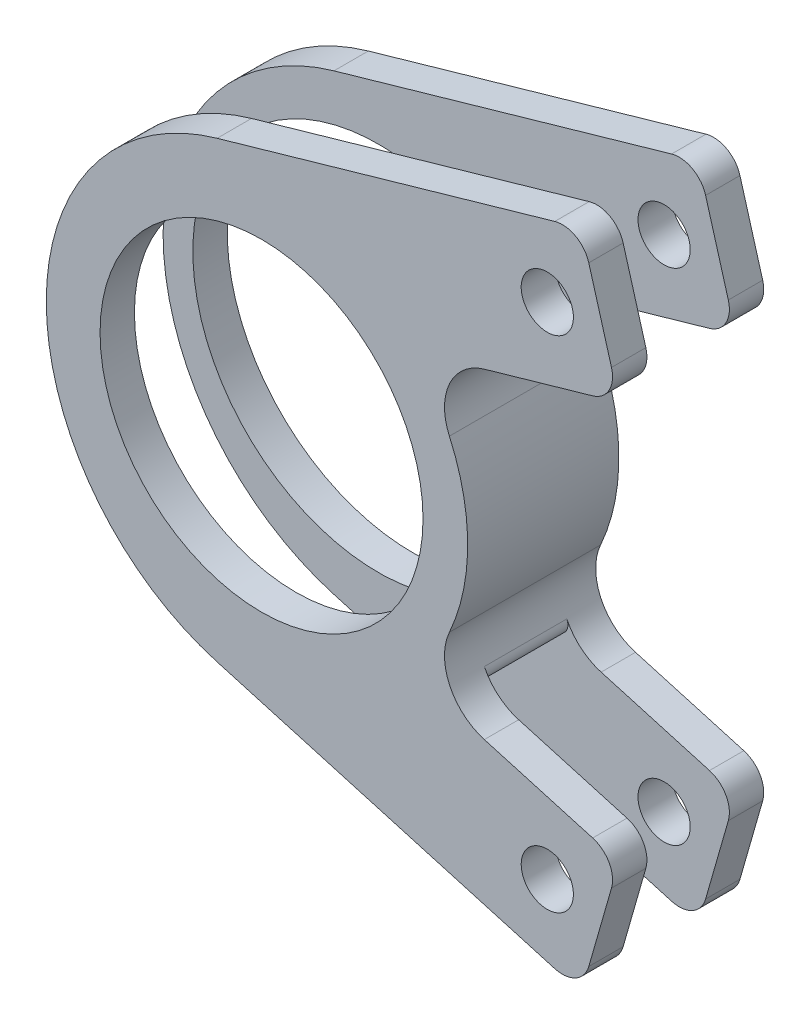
SolidWorks part; units mm, degrees
ref_plane "Plan de face" through (0, 0, 0) normal (0, 0, 1) x (1, 0, 0)
ref_plane "Plan de dessus" through (0, 0, 0) normal (0, 1, 0) x (1, 0, 0)
ref_plane "Plan de droite" through (0, 0, 0) normal (1, 0, 0) x (0, 0, -1)
sketch "Esquisse2" plane through (0, 0, 0) normal (0, 0, 1) x (1, 0, 0)
  line L0 (464.4706, 112.9482) -> (840.0604, 220.6469) construction
  line L1 (496.8579, 0) -> (841.4166, 0) construction
  line L2 (658.969, -116.7048) -> (737.7931, -139.3073)
  line L3 (496.8579, 0) -> (498.7091, 197.6026) construction
  line L4 (751.5056, 164.0452) -> (734.9673, 221.7209)
  line L5 (464.5491, 164.9857) -> (710.2293, 235.4334)
  line L6 (475.1704, -0.7722) -> (729.4546, 240.9462) construction
  line L7 (757.0183, 144.82) -> (498.7091, 197.6026) construction
  line L11 (498.7091, 197.6026) -> (475.627, 168.1623) construction
  line L12 (658.969, 116.7048) -> (737.7931, 139.3073)
  line L13 (751.5056, -164.0452) -> (734.9673, -221.7209)
  line L14 (464.5491, -164.9857) -> (710.2293, -235.4334)
  circle A0 centre (496.8579, 0) radius 117.5
  arc A1 (464.5491, 164.9857) -> (464.5491, -164.9857) centre (511.8579, 0) ccw
  circle A2 centre (704.786, 181.8576) radius 19
  arc A3 (658.969, -116.7048) -> (633.5447, -61.7797) centre (669.9945, -78.2543) cw
  arc A4 (633.5447, -61.7797) -> (633.5447, 61.7797) centre (496.8579, 0) ccw
  arc A5 (658.969, 116.7048) -> (633.5447, 61.7797) centre (669.9945, 78.2543) ccw
  arc A6 (734.9673, -221.7209) -> (710.2293, -235.4334) centre (715.7421, -216.2082) cw
  arc A7 (737.7931, -139.3073) -> (751.5056, -164.0452) centre (732.2803, -158.5325) cw
  arc A8 (734.9673, 221.7209) -> (710.2293, 235.4334) centre (715.7421, 216.2082) ccw
  arc A9 (737.7931, 139.3073) -> (751.5056, 164.0452) centre (732.2803, 158.5325) ccw
  circle A10 centre (704.786, -181.8576) radius 19
  point P9 (651.0997, 166.4633)
  point P31 (743.2364, 192.8831)
  point P34 (729.4546, -240.9462)
  point P37 (757.0183, -144.82)
  dimension "D1" = 235
  dimension "D2" = 40
  dimension "D6" = 38
  dimension "D9" = 150
  dimension "D10" = 20
  dimension "D3" = 15
  dimension "D4" = 16
  dimension "D5" = 100
  dimension "D7" = 250
  dimension "D8" = 40
extrude "Boss.-Extru.1" add sketch "Esquisse2" along normal mid plane 110 separate body
sketch "Esquisse4" plane through (0, 0, 0) normal (0, 0, 1) x (1, 0, 0)
  line L0 (849.7127, 171.3997) -> (620.0793, 105.5534)
  line L1 (658.969, 116.7048) -> (737.7931, 139.3073) construction
  line L2 (860.2294, -174.4153) -> (620.0793, -105.5534)
  line L3 (737.7931, -139.3073) -> (658.969, -116.7048) construction
  line L5 (849.7127, 171.3997) -> (849.7127, 282.3166)
  line L6 (849.7127, 282.3166) -> (305.9608, 282.3166)
  line L7 (305.9608, 282.3166) -> (305.9608, -264.0001)
  line L8 (305.9608, -264.0001) -> (860.2294, -264.0001)
  line L9 (860.2294, -264.0001) -> (860.2294, -174.4153)
  arc A0 (608.9812, -75.189) -> (608.9812, 75.189) centre (496.8579, 0) ccw
  arc A1 (633.5447, -61.7797) -> (633.5447, 61.7797) centre (496.8579, 0) ccw construction
  arc A2 (608.9812, -75.189) -> (620.0793, -105.5534) centre (625.592, -86.3281) ccw
  arc A3 (620.0793, 105.5534) -> (608.9812, 75.189) centre (625.592, 86.3281) ccw
  point P15 (631.8579, 0)
  point P16 (646.8579, 0)
  dimension "D2" = 20
  dimension "D1" = 15
extrude "Enlèv. mat.-Extru.1" cut sketch "Esquisse4" against normal mid plane 60
fillet "Congé3" radius 8 2 edges at (658.969, 116.7048, 0) (658.969, -116.7048, 0)
sketch "Esquisse5" plane through (0, 0, -30) normal (0, 0, 1) x (1, 0, 0)
  circle A1 centre (496.8579, 0) radius 135
extrude "Enlèv. mat.-Extru.2" cut sketch "Esquisse5" against normal through all
fillet "Congé4" [suppressed] radius 20
